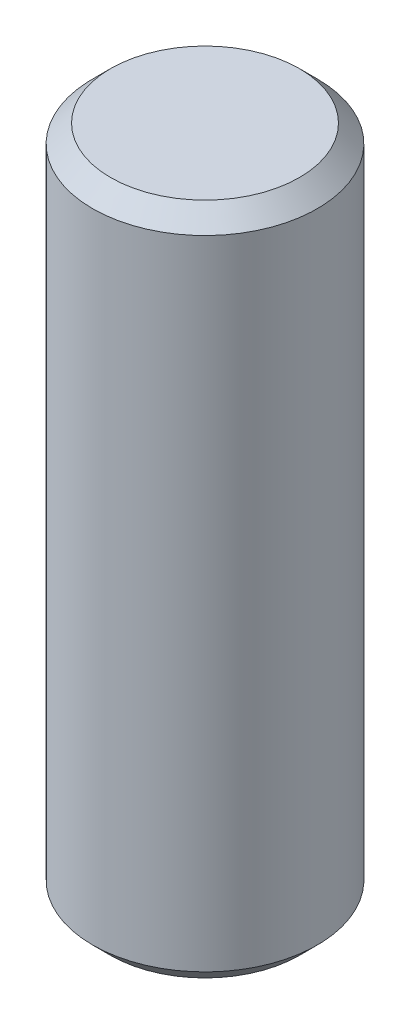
SolidWorks part; units mm, degrees
ref_plane "Front Plane" through (0, 0, 0) normal (0, 0, 1) x (1, 0, 0)
ref_plane "Top Plane" through (0, 0, 0) normal (0, 1, 0) x (1, 0, 0)
ref_plane "Right Plane" through (0, 0, 0) normal (1, 0, 0) x (0, 0, -1)
sketch "Sketch1" plane through (0, 0, 0) normal (0, 1, 0) x (1, 0, 0)
  circle A0 centre (0, 0) radius 3.1775
  dimension "D1" = 6.3551
extrude "Extrude1" add sketch "Sketch1" along normal mid plane 19.05
chamfer "Chamfer1" distance 0.508 angle 45 2 edges at (0, -9.525, 3.1775) (0, 9.525, 3.1775)
